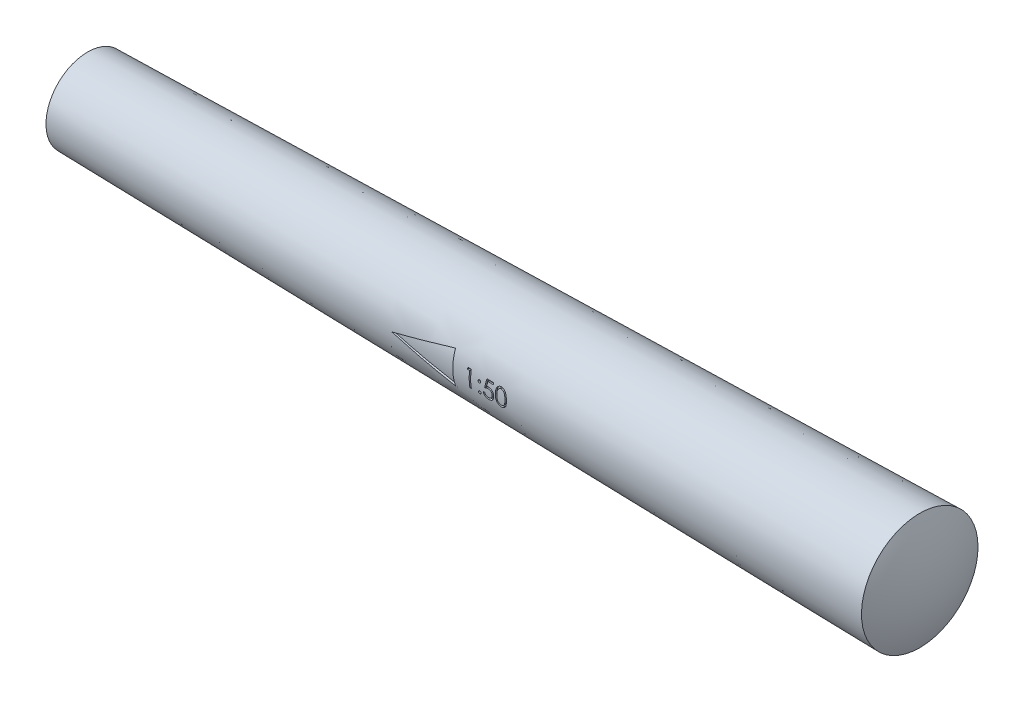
SolidWorks part; units mm, degrees
ref_plane "Front Plane" through (0, 0, 0) normal (0, 0, 1) x (1, 0, 0)
ref_plane "Top Plane" through (0, 0, 0) normal (0, 1, 0) x (1, 0, 0)
ref_plane "Right Plane" through (0, 0, 0) normal (1, 0, 0) x (0, 0, -1)
sketch "Sketch1" plane through (0, 0, 0) normal (1, 0, 0) x (0, 0, -1)
  circle A0 centre (0, 0) radius 2.5
  dimension "D1" = 5
extrude "Extrude1" add sketch "Sketch1" along normal mid plane 50
draft "Draft1" type of draft neutral plane draft angle 1.146 faces to draft 1 parameters "D1"=1.146
sketch "Sketch2" plane through (0, 0, 0) normal (0, 0, 1) x (1, 0, 0)
  line L0 (-25, 0) -> (-25, 2.5)
  line L1 (-25, 2.5) -> (-25, -2.5) construction
  line L2 (-25, 0) -> (-25.75, 0)
  line L3 (-25.75, 0) -> (-25.75, -3) construction
  line L4 (25, 0) -> (25, 3.5)
  line L5 (25, -3.5) -> (25, 3.5) construction
  line L6 (25, 0) -> (25.75, 0)
  line L7 (25.75, 0) -> (25.75, -3) construction
  line L8 (-25, -2.5) -> (25, -3.5) construction
  arc A0 (-25.75, 0) -> (-25, 2.5) centre (-21.2083, 0) cw
  arc A1 (25.75, 0) -> (25, 3.5) centre (17.2082, 0) ccw
  point P14 (0, -3)
revolve "Revolve1" add sketch "Sketch2" angle 360 about L2
sketch "Sketch5" plane through (0, 0, 0) normal (0, 0, 1) x (1, 0, 0)
  line L0 (0, 3) -> (0, -3) construction
  line L1 (25, 3.5) -> (-25, 2.5) construction
  line L2 (-25, -2.5) -> (25, -3.5) construction
ref_plane "Plane2" through (0, 0, 0) normal (-0.02, 0, 0.9998) x (0.9998, 0, 0.02)
sketch "Sketch6" plane through (0, 0, 0) normal (-0.02, 0, 0.9998) x (0.9998, 0, 0.02)
  line L0 (0, 0) -> (0, 1)
  line L1 (0, 3) -> (0, -3) construction
  line L2 (0, 1) -> (-3.7321, 0)
  line L3 (-3.7321, 0) -> (0, -1)
  line L4 (0, -1) -> (0, 0)
  line L5 (0, -0.5) -> (4, -0.5) construction
  text T0 "1:50" font "Century Gothic" height 1
  dimension "D1" = 2
  dimension "D2" = 30
  dimension "D3" = 4
wrap "Wrap2" sketch "Sketch6" wrap type deboss source sketch "Sketch6" thickness 0.1 parameters "D1"=0.1
equation "\"D2@Sketch2\" = \"D1@Sketch2\""
